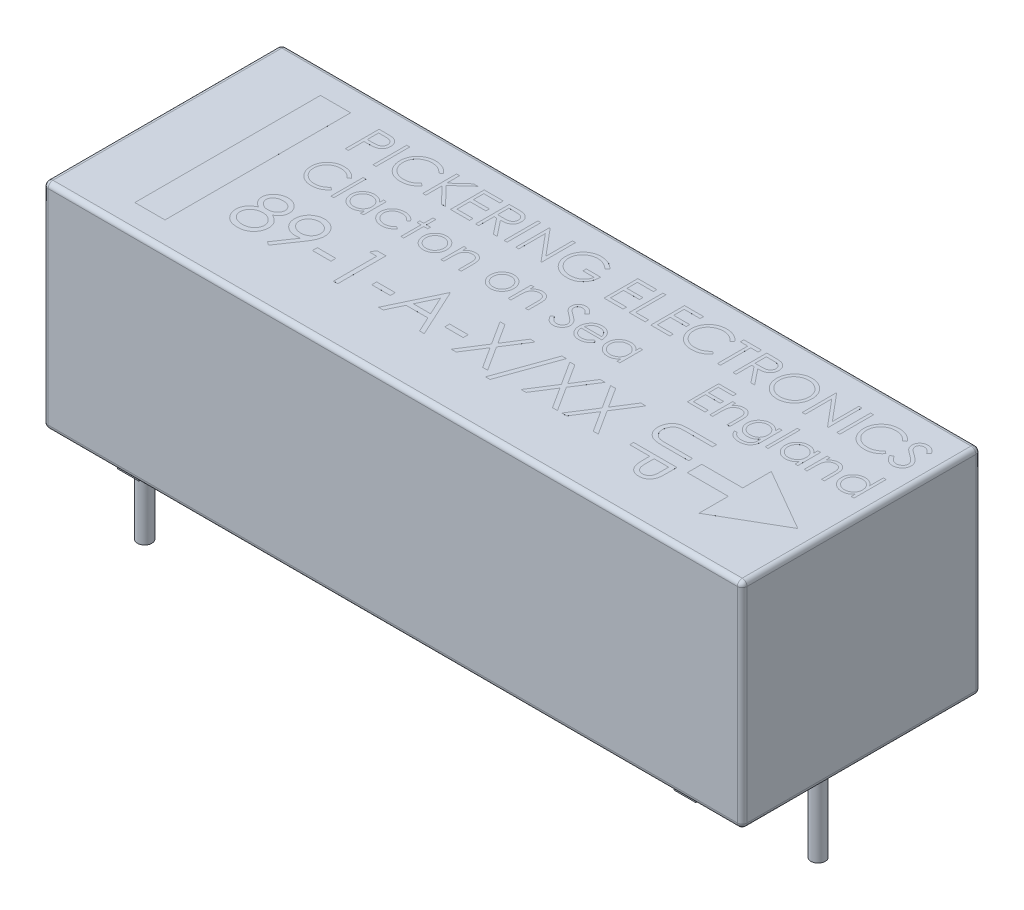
SolidWorks part; units mm, degrees
ref_plane "Front Plane" through (0, 0, 0) normal (0, 0, 1) x (1, 0, 0)
ref_plane "Top Plane" through (0, 0, 0) normal (0, 1, 0) x (1, 0, 0)
ref_plane "Right Plane" through (0, 0, 0) normal (1, 0, 0) x (0, 0, -1)
sketch "Sketch2" plane through (0, 0, 0) normal (0, 1, 0) x (1, 0, 0)
  line L1 (14.5, -4.95) -> (-14.5, -4.95)
  line L2 (14.5, -4.95) -> (14.5, 4.95)
  line L3 (14.5, 4.95) -> (-14.5, 4.95)
  line L4 (-14.5, -4.95) -> (-14.5, 4.95)
  line L5 (14.5, -4.95) -> (-14.5, 4.95) construction
  line L6 (14.5, 4.95) -> (-14.5, -4.95) construction
  point P0 (0, 0)
  dimension "D1" = 9.9
  dimension "D2" = 29
extrude "Main Body" add sketch "Sketch2" along normal blind 8.89 draft 0.023
sketch "Sketch3"
  dimension "D1" = 1.25
  dimension "D3" = 1.0965
  dimension "D4" = 2.7
  dimension "D5" = 1.4
  dimension "D6" = 2
extrude "Lettering" add sketch "Sketch3" along normal blind 0.0001
sketch "Sketch4" plane through (0, 0, 0) normal (0, -1, 0) x (1, 0, 0)
  line L0 (-14.5, -4.95) -> (-14.5, 4.95) construction
  line L1 (-12, 4.375) -> (-11.1, 4.375)
  line L2 (-12, 4.375) -> (-12, -4.375)
  line L3 (-12, -4.375) -> (-11.1, -4.375)
  line L4 (-11.1, 4.375) -> (-11.1, -4.375)
  line L5 (-14.5, 4.95) -> (14.5, 4.95) construction
  dimension "D1" = 8.75
  dimension "D2" = 0.9
  dimension "D3" = 2.5
  dimension "D4" = 0.575
extrude "Bobbin feet" add sketch "Sketch4" along normal blind 0.51
sketch "Sketch5" plane through (0, -0.51, 0) normal (0, -1, 0) x (1, 0, 0)
  line L0 (-11.1, -4.375) -> (-11.1, 4.375) construction
  line L1 (-11.1, -2.9375) -> (-12, -2.9375)
  line L2 (-11.1, -2.9375) -> (-11.1, -1.9375)
  line L3 (-11.1, -1.9375) -> (-12, -1.9375)
  line L4 (-12, -2.9375) -> (-12, -1.9375)
  line L5 (-12, 4.375) -> (-12, -4.375) construction
  line L6 (-12, 4.375) -> (-12, -4.375) construction
  line L7 (-12, -0.5) -> (-11.1, -0.5)
  line L8 (-12, -0.5) -> (-12, 0.5)
  line L9 (-12, 0.5) -> (-11.1, 0.5)
  line L10 (-11.1, -0.5) -> (-11.1, 0.5)
  line L11 (-11.1, 1.9375) -> (-12, 1.9375)
  line L12 (-11.1, 1.9375) -> (-11.1, 2.9375)
  line L13 (-11.1, 2.9375) -> (-12, 2.9375)
  line L14 (-12, 1.9375) -> (-12, 2.9375)
  line L15 (-12, -4.375) -> (-11.1, -4.375) construction
  dimension "D1" = 1.4375
  dimension "D2" = 1
  dimension "D3" = 1.4375
  dimension "D4" = 1
  dimension "D5" = 1
  dimension "D6" = 1.4375
extrude "Bobbin feet cut" cut sketch "Sketch5" against normal up to surface (0.51 mm away)
sketch "Sketch8" plane through (0, 0, 0) normal (0, -1, 0) x (1, 0, 0)
  line L0 (-14.5, -4.95) -> (-14.5, 4.95) construction
  line L1 (-12, -4.375) -> (-13.925, -4.375)
  line L2 (-12, -4.375) -> (-12, -2.9375)
  line L3 (-12, -2.9375) -> (-13.925, -2.9375)
  line L4 (-13.925, -4.375) -> (-13.925, -2.9375)
  line L5 (-12, -2.9375) -> (-11.1, -2.9375) construction
  dimension "D1" = 0.575
extrude "Extrude5" add sketch "Sketch8" along normal blind 0.1
pattern_linear "LPattern1" count 4 spacing 2.4385 along (0, 0, 1) of "Extrude5"
mirror "Mirror1" about plane through (0, 0, 0) normal (1, 0, 0) of "Extrude5", "Bobbin feet cut", "Bobbin feet", "LPattern1"
sketch "Sketch9" plane through (0, 0, 0) normal (0, -1, 0) x (1, 0, 0)
  line L1 (14.5, 4.95) -> (14.5, -4.95) construction
  circle A1 centre (12.7, 0) radius 0.2963
  dimension "D4" = 1.8
extrude "Pins" add sketch "Sketch9" along normal blind 4.31
sketch "Sketch10" plane through (0, 0, 0) normal (0, -1, 0) x (1, 0, 0)
  line L0 (14.5, -4.95) -> (-14.5, -4.95) construction
  line L1 (-14.5, -4.95) -> (-14.5, 4.95) construction
  circle A0 centre (-12.7, -2.54) radius 0.3
  circle A1 centre (-12.7, 0) radius 0.3
  circle A2 centre (-12.7, 2.54) radius 0.3
  dimension "D1" = 0.6
  dimension "D2" = 0.6
  dimension "D3" = 0.6
  dimension "D4" = 2.41
  dimension "D5" = 2.54
  dimension "D6" = 2.54
  dimension "D7" = 1.8
extrude "Extrude7" add sketch "Sketch10" along normal blind 4.31
fillet "Fillet1" radius 0.2 12 edges at (14.4965, 8.89, 0) (14.5, 0, 0) (14.4983, 4.445, -4.9483) (0, 8.89, -4.9465) (0, 0, -4.95) (-14.4983, 4.445, -4.9483) (-14.4965, 8.89, 0) (-14.5, 0, 0) (-14.4983, 4.445, 4.9483) (0, 8.89, 4.9465) (14.4983, 4.445, 4.9483) (0, 0, 4.95)
sketch "Sketch11"
sketch_block_instance "UP-1"
sketch_block "UP"
sketch_block_instance "Block1-1"
sketch_block "Block1" parameters "D1"=1.7, "D2"=2.2, "D3"=2.6, "D4"=1.24
extrude "Arrow" add sketch "Sketch11" along normal blind 0.0001
